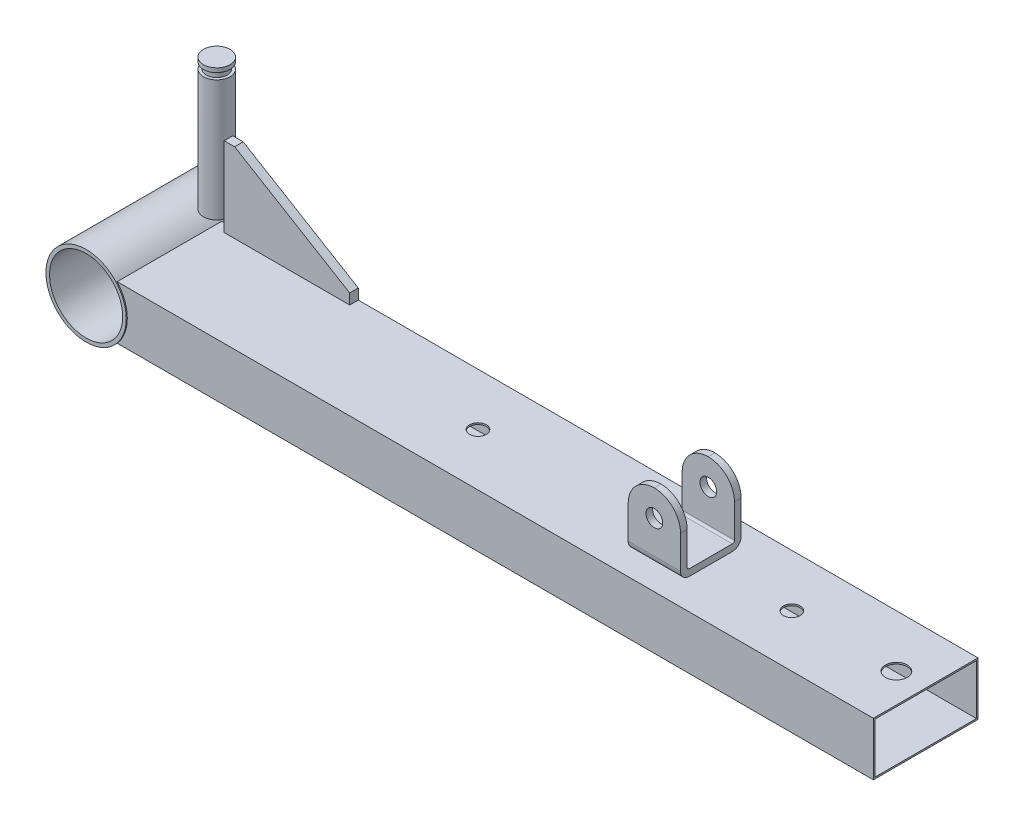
SolidWorks part; units mm, degrees
ref_plane "Plan1" through (0, 0, 0) normal (0, 0, 1) x (1, 0, 0)
ref_plane "Plan2" through (0, 0, 0) normal (0, 1, 0) x (1, 0, 0)
ref_plane "Plan3" through (0, 0, 0) normal (1, 0, 0) x (0, 0, -1)
sketch "Esquisse1" plane through (0, 0, 0) normal (0, 0, 1) x (1, 0, 0)
  circle A0 centre (0, 0) radius 19.2
  circle A1 centre (0, 0) radius 17.5
  dimension "D1" = 38.4
  dimension "D2" = 35
extrude "Base-Extrusion" add sketch "Esquisse1" along normal blind 74.3
ref_plane "Plan4" through (375.8, 0, 0) normal (1, 0, 0) x (0, 0, -1)
sketch "Esquisse2" plane through (375.8, 0, 0) normal (1, 0, 0) x (0, 0, -1)
  line L1 (-23.8, 12.75) -> (-73.8, 12.75)
  line L2 (-23.8, 12.75) -> (-23.8, -12.75)
  line L3 (-23.8, -12.75) -> (-73.8, -12.75)
  line L4 (-73.8, 12.75) -> (-73.8, -12.75)
  line L5 (-24.55, 12) -> (-73.05, 12)
  line L6 (-73.05, 12) -> (-73.05, -12)
  line L7 (-24.55, -12) -> (-73.05, -12)
  line L8 (-24.55, 12) -> (-24.55, -12)
  line L9 (-74.3, 19.2) -> (-74.3, -19.2) construction
  dimension "D1" = 50
  dimension "D2" = 25.5
  dimension "D3" = 0.5
  dimension "D4" = 12.75
  dimension "D5" = 0.75
extrude "Boss.-Extru.1" add sketch "Esquisse2" against normal up to next
ref_plane "Plan5" through (273.1, 0, 0) normal (1, 0, 0) x (0, 0, -1)
sketch "Esquisse9" plane through (273.1, 0, 0) normal (1, 0, 0) x (0, 0, -1)
  line L0 (-59.1, 12.75) -> (-38.5, 12.75)
  line L1 (-34.3, 16.95) -> (-34.3, 45.25)
  line L2 (-63.3, 16.95) -> (-63.3, 45.25)
  line L3 (-60.1, 16.95) -> (-60.1, 45.25)
  line L4 (-59.1, 15.95) -> (-38.5, 15.95)
  line L5 (-37.5, 16.95) -> (-37.5, 45.25)
  line L6 (-63.3, 45.25) -> (-60.1, 45.25)
  line L7 (-37.5, 45.25) -> (-34.3, 45.25)
  line L9 (-73.8, 12.75) -> (-73.8, -12.75) construction
  arc A0 (-60.1, 16.95) -> (-59.1, 15.95) centre (-59.1, 16.95) ccw
  arc A1 (-38.5, 15.95) -> (-37.5, 16.95) centre (-38.5, 16.95) ccw
  arc A2 (-59.1, 12.75) -> (-63.3, 16.95) centre (-59.1, 16.95) cw
  arc A3 (-38.5, 12.75) -> (-34.3, 16.95) centre (-38.5, 16.95) ccw
  point P15 (-63.3, 12.75)
  point P18 (-34.3, 12.75)
  dimension "D5" = 1
  dimension "D6" = 4.2
  dimension "D2" = 29
  dimension "D3" = 32.5
  dimension "D1" = 32.5
  dimension "D7" = 10.5
  dimension "D4" = 3.2
extrude "Boss.-Extru.7" add sketch "Esquisse9" against normal blind 25
fillet "Congé7" radius 12.5
other "Perçage1"
sketch "Esquisse10" plane through (0, 0, 63.3) normal (0, 0, 1) x (1, 0, 0)
  circle A0 centre (260.6, 32.75) radius 4
  arc A1 (273.1, 32.75) -> (260.6, 45.25) centre (260.6, 32.75) ccw construction
  dimension "D1" = 8
ref_plane "Plan6" through (0, 17.75, 0) normal (0, 1, 0) x (-1, 0, 0)
sketch "Esquisse11" plane through (0, 17.75, 0) normal (0, 1, 0) x (-1, 0, 0)
  line L1 (-375.8, 73.8) -> (-375.8, 23.8) construction
  line L2 (-19.2, 0) -> (19.2, 0) construction
  circle A0 centre (-13.15, 25) radius 6.35
  dimension "D1" = 12.7
  dimension "D2" = 25
  dimension "D3" = 362.65
extrude "Boss.-Extru.11" add sketch "Esquisse11" along normal blind 58
sketch "Esquisse12" plane through (0, 75.75, 0) normal (0, 1, 0) x (-1, 0, 0)
  circle A0 centre (-13.15, 25) radius 5
  circle A1 centre (-13.15, 25) radius 6.35 construction
  dimension "D1" = 10
extrude "Boss.-Extru.12" add sketch "Esquisse12" along normal blind 3
sketch "Esquisse13" plane through (0, 78.75, 0) normal (0, 1, 0) x (-1, 0, 0)
  circle A0 centre (-13.15, 25) radius 6.35
  dimension "D1" = 12.7
extrude "Boss.-Extru.13" add sketch "Esquisse13" along normal blind 2
other "Perçage2"
sketch "Esquisse16" plane through (0, 12.75, 0) normal (0, 1, 0) x (-1, 0, 0)
  line L0 (-375.8, 23.8) -> (-375.8, 73.8) construction
  line L1 (-14.3554, 73.8) -> (-375.8, 73.8) construction
  circle A0 centre (-311.8, 48.8) radius 4
  dimension "D1" = 8
  dimension "D2" = 64
  dimension "D3" = 25
other "Perçage3"
sketch "Esquisse17" plane through (0, -12.75, 0) normal (0, -1, 0) x (1, 0, 0)
  circle A0 centre (311.8, 48.8) radius 5.75
  circle A2 centre (311.8, 48.8) radius 4 construction
  dimension "D1" = 11.5
other "Perçage4"
sketch "Esquisse18" plane through (0, 12.75, 0) normal (0, 1, 0) x (-1, 0, 0)
  line L0 (-375.8, 23.8) -> (-375.8, 73.8) construction
  line L1 (-14.3554, 73.8) -> (-375.8, 73.8) construction
  circle A0 centre (-361.8, 48.8) radius 5.2
  dimension "D1" = 10.4
  dimension "D2" = 14
  dimension "D3" = 25
pattern_linear "Répétition linéaire1" count 2 spacing 150
sketch "Esquisse20" plane through (0, 0, 23.8) normal (0, 0, -1) x (-1, 0, 0)
  line L0 (-19.6, 12.75) -> (-79.6, 12.75)
  line L1 (-14.3554, 12.75) -> (-375.8, 12.75) construction
  line L2 (-79.6, 12.75) -> (-79.6, 17.75)
  line L3 (-19.6, 12.75) -> (-19.6, 50.75)
  line L4 (-19.6, 50.75) -> (-24.6, 50.75)
  line L5 (-24.6, 50.75) -> (-79.6, 17.75)
  circle A0 centre (0, 0) radius 17.5 construction
  dimension "D1" = 5
  dimension "D2" = 5
  dimension "D3" = 60
  dimension "D4" = 38
  dimension "D5" = 19.6
extrude "Boss.-Extru.19" add sketch "Esquisse20" against normal blind 4.1
